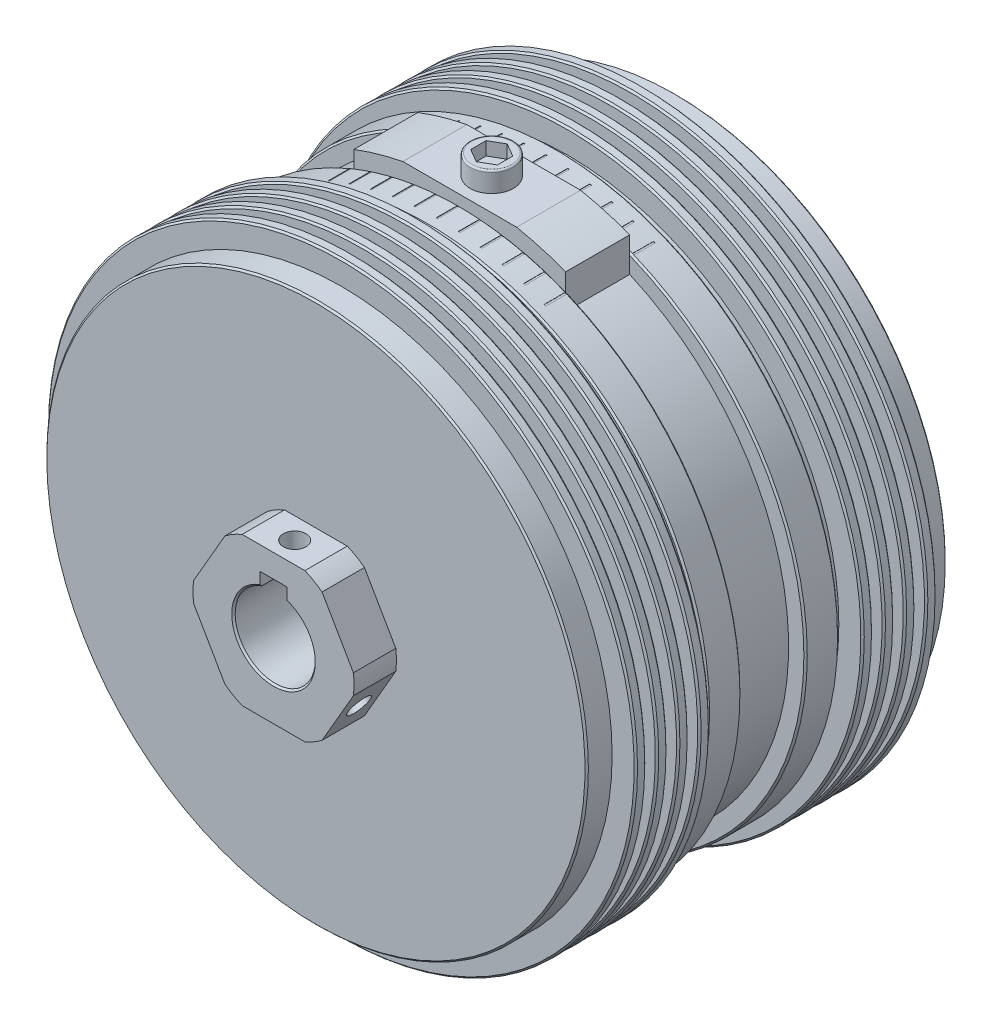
SolidWorks part; units mm, degrees
ref_plane "Front Plane" through (0, 0, 0) normal (0, 0, 1) x (1, 0, 0)
ref_plane "Top Plane" through (0, 0, 0) normal (0, 1, 0) x (1, 0, 0)
ref_plane "Right Plane" through (0, 0, 0) normal (1, 0, 0) x (0, 0, -1)
sketch "Sketch1" plane through (0, 0, 0) normal (1, 0, 0) x (0, 0, -1)
  line L0 (0, 0) -> (154.6696, 0) construction
  line L1 (0, 0) -> (0, 12.0002) construction
  line L2 (0, 24.13) -> (12.7, 24.13)
  line L3 (131.2418, 28.956) -> (131.2418, 19.812)
  line L4 (12.7, 24.13) -> (12.7, 81.153)
  line L5 (12.7, 81.153) -> (20.32, 81.153)
  line L6 (20.32, 81.153) -> (20.32, 88.265)
  line L7 (20.32, 88.265) -> (23.495, 88.265)
  line L8 (45.72, 84.455) -> (45.72, 81.153)
  line L9 (26.67, 88.265) -> (29.845, 88.265)
  line L10 (33.02, 88.265) -> (36.195, 88.265)
  line L11 (45.72, 84.455) -> (55.8165, 84.455)
  line L12 (55.8165, 84.455) -> (55.8165, 79.375)
  line L13 (55.8165, 79.375) -> (74.9935, 79.375)
  line L14 (74.9935, 79.375) -> (74.9935, 84.455)
  line L15 (74.9935, 84.455) -> (85.09, 84.455)
  line L16 (107.315, 88.265) -> (107.315, 81.153)
  line L17 (107.315, 81.153) -> (104.14, 81.153)
  line L18 (131.2418, 19.812) -> (134.112, 19.812)
  line L19 (88.265, 88.265) -> (91.44, 88.265)
  line L20 (110.49, 88.265) -> (110.49, 81.153)
  line L21 (110.49, 81.153) -> (120.65, 81.153)
  line L22 (120.65, 81.153) -> (120.65, 41.656)
  line L23 (121.031, 41.275) -> (123.698, 41.275)
  line L24 (123.698, 41.275) -> (123.698, 28.956)
  line L25 (123.698, 28.956) -> (131.2418, 28.956)
  line L28 (134.112, 19.812) -> (134.112, 12.0002)
  line L29 (134.112, 12.0002) -> (0, 12.0002)
  line L30 (23.495, 88.265) -> (23.495, 81.153)
  line L31 (23.495, 81.153) -> (26.67, 81.153)
  line L32 (26.67, 81.153) -> (26.67, 88.265)
  line L33 (29.845, 88.265) -> (29.845, 81.153)
  line L34 (29.845, 81.153) -> (33.02, 81.153)
  line L35 (33.02, 81.153) -> (33.02, 88.265)
  line L36 (36.195, 88.265) -> (36.195, 81.153)
  line L37 (36.195, 81.153) -> (39.37, 81.153)
  line L38 (39.37, 81.153) -> (39.37, 88.265)
  line L39 (42.545, 88.265) -> (42.545, 81.153)
  line L40 (39.37, 88.265) -> (42.545, 88.265)
  line L41 (42.545, 81.153) -> (45.72, 81.153)
  line L42 (104.14, 81.153) -> (104.14, 88.265)
  line L43 (107.315, 88.265) -> (110.49, 88.265)
  line L44 (100.965, 88.265) -> (100.965, 81.153)
  line L45 (100.965, 81.153) -> (97.79, 81.153)
  line L46 (97.79, 81.153) -> (97.79, 88.265)
  line L47 (100.965, 88.265) -> (104.14, 88.265)
  line L48 (94.615, 88.265) -> (94.615, 81.153)
  line L49 (94.615, 81.153) -> (91.44, 81.153)
  line L50 (91.44, 81.153) -> (91.44, 88.265)
  line L51 (94.615, 88.265) -> (97.79, 88.265)
  line L52 (88.265, 88.265) -> (88.265, 81.153)
  line L53 (88.265, 81.153) -> (85.09, 81.153)
  line L54 (85.09, 81.153) -> (85.09, 84.455)
  line L59 (0, 24.13) -> (0, 12.0002)
  arc A0 (121.031, 41.275) -> (120.65, 41.656) centre (121.031, 41.656) cw
  dimension "D35" = 0.381
  dimension "D2" = 176.53
  dimension "D4" = 24.0005
  dimension "D5" = 158.75
  dimension "D6" = 168.91
  dimension "D7" = 57.912
  dimension "D8" = 107.95
  dimension "D9" = 13.462
  dimension "D10" = 82.55
  dimension "D11" = 3.048
  dimension "D12" = 134.112
  dimension "D13" = 19.177
  dimension "D14" = 7.62
  dimension "D15" = 25.4
  dimension "D16" = 3.175
  dimension "D17" = 3.175
  dimension "D18" = 3.175
  dimension "D19" = 3.175
  dimension "D20" = 3.175
  dimension "D21" = 3.175
  dimension "D22" = 3.175
  dimension "D23" = 3.175
  dimension "D24" = 7.112
  dimension "D25" = 3.175
  dimension "D26" = 3.175
  dimension "D27" = 90.17
  dimension "D28" = 3.175
  dimension "D29" = 3.175
  dimension "D30" = 3.175
  dimension "D31" = 3.175
  dimension "D32" = 3.175
  dimension "D33" = 48.26
  dimension "D34" = 35.4965
  dimension "D37" = 2.8702
  dimension "D36" = 39.624
revolve "Revolve1" add sketch "Sketch1" angle 360 about L0
chamfer "Chamfer1" distance 0.508 angle 45 23 edges at (88.265, 0, -110.49) (88.265, 0, -107.315) (88.265, 0, -104.14) (88.265, 0, -100.965) (88.265, 0, -97.79) (88.265, 0, -94.615) (88.265, 0, -91.44) (88.265, 0, -88.265) (84.455, 0, -85.09) (84.455, 0, -74.9935) (84.455, 0, -55.8165) (84.455, 0, -45.72) (88.265, 0, -42.545) (88.265, 0, -39.37) (88.265, 0, -36.195) (88.265, 0, -33.02) (88.265, 0, -29.845) (88.265, 0, -26.67) (88.265, 0, -23.495) (88.265, 0, -20.32) (41.275, 0, -123.698) (12.0002, 0, 0) (12.0002, 0, -134.112)
ref_plane "Plane1" through (0, 0, -55.8165) normal (0, 0, -1) x (-1, 0, 0)
sketch "Sketch4" plane through (0, 0, -55.8165) normal (0, 0, -1) x (-1, 0, 0)
  line L0 (0, 79.375) -> (0, 93.3454) construction
  line L1 (31.75, 72.7484) -> (31.75, 83.037)
  line L2 (-31.75, 72.7484) -> (-31.75, 83.037)
  line L3 (-31.75, 79.375) -> (-31.75, 93.3454) construction
  line L4 (31.75, 79.375) -> (31.75, 93.3454) construction
  line L5 (0, 87.2518) -> (17.0392, 87.2518)
  line L6 (0, 87.2518) -> (-17.0392, 87.2518)
  circle A0 centre (0, 0) radius 79.375 construction
  circle A1 centre (0, 0) radius 79.375
  arc A2 (31.75, 83.037) -> (17.0392, 87.2518) centre (0, 0) ccw
  arc A3 (-17.0392, 87.2518) -> (-31.75, 83.037) centre (0, 0) ccw
  dimension "D1" = 177.8
  dimension "D4" = 14.5034
  dimension "D2" = 31.75
  dimension "D3" = 31.75
extrude "Boss-Extrude1" add sketch "Sketch4" along normal up to surface (19.177 mm away) contours L6 A3 L2 A1 L1 A2 L5
sketch "Sketch5" plane through (0, 87.2518, 0) normal (0, 1, 0) x (1, 0, 0)
  line L0 (0, 55.8165) -> (0, 74.9935) construction
  line L1 (-17.0392, 55.8165) -> (17.0392, 55.8165) construction
  line L3 (31.75, 74.9935) -> (-31.75, 74.9935) construction
  circle A0 centre (0, 65.405) radius 6.5024
  dimension "D1" = 13.0048
extrude "Boss-Extrude2" add sketch "Sketch5" along normal blind 5.9944
sketch "Sketch6" plane through (0, 93.2462, 0) normal (0, 1, 0) x (-1, 0, 0)
  line L0 (0, -65.405) -> (0, -60.7856) construction
  line L1 (-4.0005, -63.0953) -> (-4.0005, -67.7147)
  line L2 (-4.0005, -67.7147) -> (0, -70.0244)
  line L3 (0, -70.0244) -> (4.0005, -67.7147)
  line L4 (4.0005, -67.7147) -> (4.0005, -63.0953)
  line L5 (4.0005, -63.0953) -> (0, -60.7856)
  line L6 (0, -60.7856) -> (-4.0005, -63.0953)
  circle A0 centre (0, -65.405) radius 4.0005 construction
  dimension "D1" = 8.001
extrude "Cut-Extrude3" cut sketch "Sketch6" against normal blind 3.9878
fillet "Fillet2" radius 0.508 1 edges at (0, 93.2462, -58.9026)
pattern_circular "CirPattern2" count 2 over 360 about axis through (0, 0, 0) along (0, 0, 1) of "Fillet2", "Cut-Extrude3", "Boss-Extrude2", "Boss-Extrude1"
chamfer "Chamfer3" distance 0.508 angle 45 2 edges at (81.153, 0, -120.65) (81.153, 0, -12.7)
ref_plane "Plane2" through (0, 84.455, 0) normal (0, 1, 0) x (-1, 0, 0)
sketch "Sketch19" plane through (0, 84.455, 0) normal (0, 1, 0) x (-1, 0, 0)
  line L0 (0, -74.9935) -> (0, -84.582) construction
  line L1 (83.947, -74.9935) -> (-83.947, -74.9935) construction
  line L2 (-84.455, -84.582) -> (84.455, -84.582) construction
  line L3 (0, -46.228) -> (0, -55.3085) construction
  line L4 (84.455, -46.228) -> (-84.455, -46.228) construction
  line L5 (-84.455, -55.3085) -> (84.455, -55.3085) construction
  line L6 (-0.254, -48.9585) -> (-0.254, -55.3085)
  line L7 (-0.254, -75.5015) -> (-0.254, -81.8015)
  line L8 (0.254, -48.9585) -> (0.254, -55.3085)
  line L9 (0.254, -75.5015) -> (0.254, -81.8015)
  line L10 (-0.254, -55.3085) -> (0.254, -55.3085)
  line L11 (-0.254, -48.9585) -> (0.254, -48.9585)
  line L12 (-0.254, -46.228) -> (-0.254, -55.3085) construction
  line L13 (0.254, -46.228) -> (0.254, -55.3085) construction
  line L14 (-0.254, -74.9935) -> (-0.254, -84.582) construction
  line L15 (84.455, -75.5015) -> (-84.455, -75.5015) construction
  line L16 (0.254, -74.9935) -> (0.254, -84.582) construction
  line L17 (-0.254, -75.5015) -> (0.254, -75.5015)
  line L18 (-0.254, -81.8015) -> (0.254, -81.8015)
  dimension "D3" = 6.35
  dimension "D4" = 6.3
  dimension "D1" = 0.254
  dimension "D2" = 0.254
extrude "Cut-Extrude10" cut sketch "Sketch19" against normal blind 0.1016
pattern_circular "CirPattern8" count 6 over 22.5 about axis through (0, 0, 0) along (0, 0, 1) of "Cut-Extrude10"
pattern_circular "CirPattern9" count 6 over 22.5 about axis through (0, 0, 0) along (0, 0, 1) of "Cut-Extrude10"
hole_wizard "M8x1.25 Tapped Hole1" positions "Sketch21" profile "Sketch20" tap size "M8x1.25" standard "ANSI Metric"
sketch "Sketch21" plane through (0, 0, -120.65) normal (0, 0, -1) x (-1, 0, 0)
  line L0 (0, 0) -> (0, 50.8) construction
  point P0 (0, 50.8)
  dimension "D1" = 50.8
sketch "Sketch20" plane through (0, 50.8, -120.65) normal (1, 0, 0) x (0, 1, 0)
  line L0 (0, 0) -> (0, 18.8069)
  line L1 (0, 18.8069) -> (3.4, 16.764)
  line L2 (3.4, 16.764) -> (3.4, 0)
  line L5 (3.4, 0) -> (0, 0)
  line L10 (0, 18.8069) -> (-3.4, 16.764) construction
  line L11 (0, -6.35) -> (0, 107.95) construction
  dimension "Tap Drill Dia." = 6.8
  dimension "Tap Drill Depth" = 16.764
  dimension "Drill Angle" = 118
pattern_circular "CirPattern10" count 3 over 360 about axis through (0, 0, 0) along (0, 0, 1) of "M8x1.25 Tapped Hole1"
sketch "Sketch22" plane through (0, 0, 0) normal (0, 0, 1) x (1, 0, 0)
  line L0 (0, 0) -> (0, 22.225) construction
  line L1 (-12.8316, 22.225) -> (-25.6632, 0)
  line L2 (-25.6632, 0) -> (-12.8316, -22.225)
  line L3 (-12.8316, -22.225) -> (12.8316, -22.225)
  line L4 (12.8316, -22.225) -> (25.6632, 0)
  line L5 (25.6632, 0) -> (12.8316, 22.225)
  line L6 (12.8316, 22.225) -> (-12.8316, 22.225)
  circle A0 centre (0, 0) radius 22.225 construction
  dimension "D1" = 44.45
extrude "Cut-Extrude11" cut sketch "Sketch22" against normal blind 12.7 flip side to cut
sketch "Sketch23" plane through (0, 0, 0) normal (0, 0, 1) x (1, 0, 0)
  line L0 (0, 0) -> (0, 7.3038) construction
  line L1 (0, 7.3038) -> (4.0005, 7.3038)
  line L2 (4.0005, 7.3038) -> (4.0005, 15.3048)
  line L3 (4.0005, 15.3048) -> (-4.0005, 15.3048)
  line L4 (-4.0005, 15.3048) -> (-4.0005, 7.3038)
  line L5 (-4.0005, 7.3038) -> (0, 7.3038)
  circle A0 centre (0, 0) radius 12.0002 construction
  dimension "D1" = 8.001
  dimension "D2" = 8.001
  dimension "D3" = 27.305
extrude "Cut-Extrude12" cut sketch "Sketch23" against normal through all
hole_wizard "M8x1.25 Tapped Hole2" positions "Sketch25" profile "Sketch24" tap size "M8x1.25" standard "ANSI Metric"
sketch "Sketch25" plane through (19.2474, -11.1125, 0) normal (0.866, -0.5, 0) x (0, 0, -1)
  line L0 (0, 0) -> (6.35, 0) construction
  point P0 (6.35, 0)
  dimension "D1" = 6.35
sketch "Sketch24" plane through (19.2474, -11.1125, -6.35) normal (0, 0, 1) x (0.5, 0.866, 0)
  line L0 (0, 0) -> (0, 44.45)
  line L1 (0, 44.45) -> (3.4, 44.45)
  line L2 (3.4, 44.45) -> (3.4, 0)
  line L5 (3.4, 0) -> (0, 0)
  line L11 (0, -6.35) -> (0, 107.95) construction
  dimension "Thru Tap Drill Dia." = 6.8
  dimension "Thru Tap Drill Depth" = 44.45
pattern_circular "CirPattern11" count 2 over 120 about axis through (0, 0, 0) along (0, 0, 1) of "M8x1.25 Tapped Hole2"
sketch "Sketch26" plane through (0, 0, -134.112) normal (0, 0, -1) x (-1, 0, 0)
  line L0 (0, -28.956) -> (0, 28.956) construction
  line L1 (-28.956, 0) -> (28.956, 0) construction
  line L2 (3.175, -28.7814) -> (3.175, -26.3144)
  line L3 (-28.7814, -3.175) -> (-26.3144, -3.175)
  line L4 (-3.175, -28.7814) -> (-3.175, -26.3144)
  line L5 (-28.7814, 3.175) -> (-26.3144, 3.175)
  line L6 (-28.956, 3.175) -> (28.956, 3.175) construction
  line L7 (-28.956, -3.175) -> (28.956, -3.175) construction
  line L8 (-3.175, -28.956) -> (-3.175, 28.956) construction
  line L9 (3.175, -28.956) -> (3.175, 28.956) construction
  line L10 (-3.175, 26.3144) -> (3.175, 26.3144)
  line L11 (-3.175, 26.3144) -> (-3.175, 28.7814)
  line L12 (3.175, 26.3144) -> (3.175, 28.7814)
  line L13 (-26.3144, -3.175) -> (-26.3144, 3.175)
  line L14 (26.3144, -3.175) -> (26.3144, 3.175)
  line L15 (-3.175, -26.3144) -> (3.175, -26.3144)
  line L18 (26.3144, 3.175) -> (28.7814, 3.175)
  line L19 (26.3144, -3.175) -> (28.7814, -3.175)
  circle A0 centre (0, 0) radius 28.956 construction
  arc A1 (-28.7814, 3.175) -> (-28.7814, -3.175) centre (0, 0) ccw
  arc A2 (3.175, 28.7814) -> (-3.175, 28.7814) centre (0, 0) ccw
  arc A3 (-3.175, -28.7814) -> (3.175, -28.7814) centre (0, 0) ccw
  arc A4 (28.7814, -3.175) -> (28.7814, 3.175) centre (0, 0) ccw
  dimension "D3" = 2.6416
  dimension "D4" = 2.6416
  dimension "D5" = 2.6416
  dimension "D6" = 2.6416
  dimension "D1" = 3.175
  dimension "D2" = 3.175
extrude "Cut-Extrude13" cut sketch "Sketch26" against normal up to surface (10.414 mm away)
